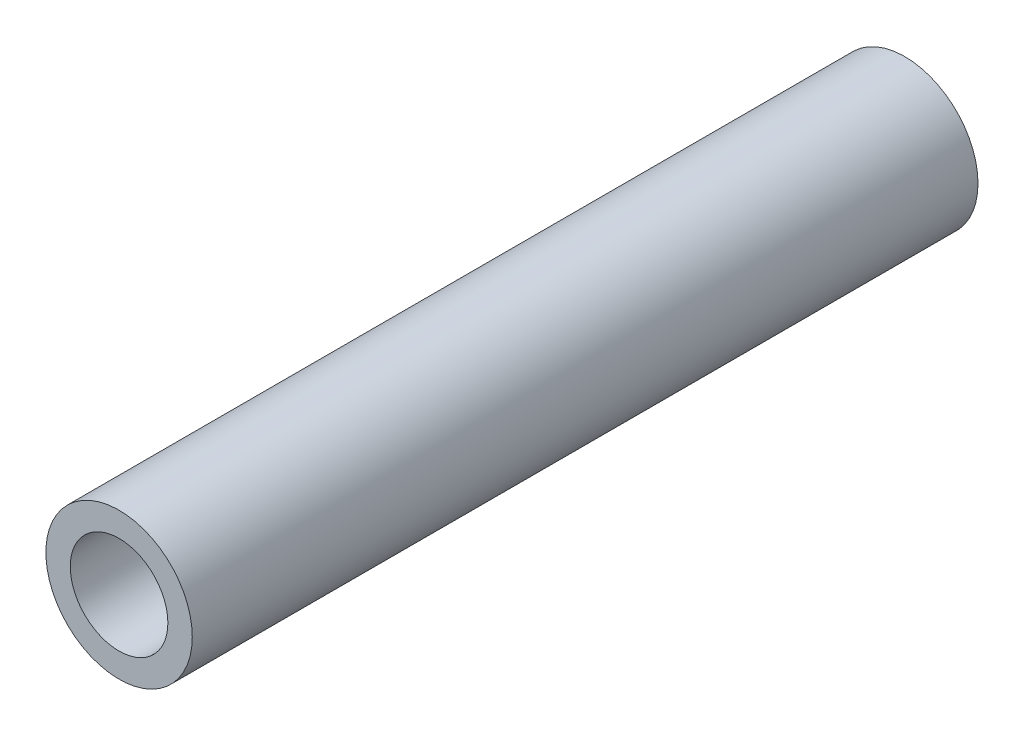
SolidWorks part; units mm, degrees
ref_plane "Спереди" through (0, 0, 0) normal (0, 0, 1) x (1, 0, 0)
ref_plane "Сверху" through (0, 0, 0) normal (0, 1, 0) x (1, 0, 0)
ref_plane "Справа" through (0, 0, 0) normal (1, 0, 0) x (0, 0, -1)
sketch "Эскиз1" plane through (0, 0, 0) normal (0, 0, 1) x (1, 0, 0)
  circle A0 centre (0, 0) radius 1
  circle A1 centre (0, 0) radius 1.5
  dimension "D1" = 3
  dimension "D2" = 2
extrude "Бобышка-Вытянуть1" add sketch "Эскиз1" along normal blind 16.1
